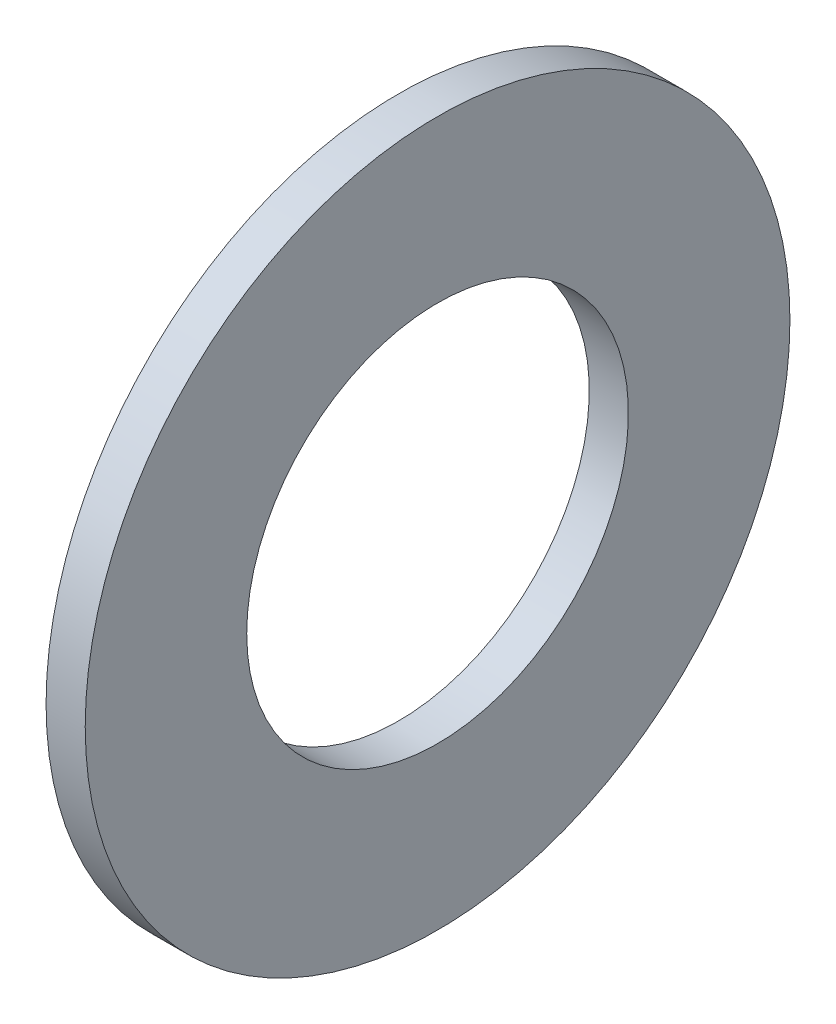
SolidWorks part; units mm, degrees
ref_plane "Plane1" through (0, 0, 0) normal (0, 0, 1) x (1, 0, 0)
ref_plane "Plane2" through (0, 0, 0) normal (0, 1, 0) x (1, 0, 0)
ref_plane "Plane3" through (0, 0, 0) normal (1, 0, 0) x (0, 0, -1)
other "Configuration Table"
sketch "Sketch1" plane through (0, 0, 0) normal (0, 0, 1) x (1, 0, 0)
  line L0 (-34.925, 0) -> (9.525, 0) construction
  line L1 (0, 19.5) -> (0, 36)
  line L2 (0, 36) -> (-4, 36)
  line L3 (-4, 36) -> (-4, 19.5)
  line L4 (-4, 19.5) -> (0, 19.5)
  dimension "Thickness" = 4
  dimension "Inside_dia" = 39
  dimension "Outside_dia" = 72
revolve "Base-Revolve" add sketch "Sketch1" angle 360 about L0
